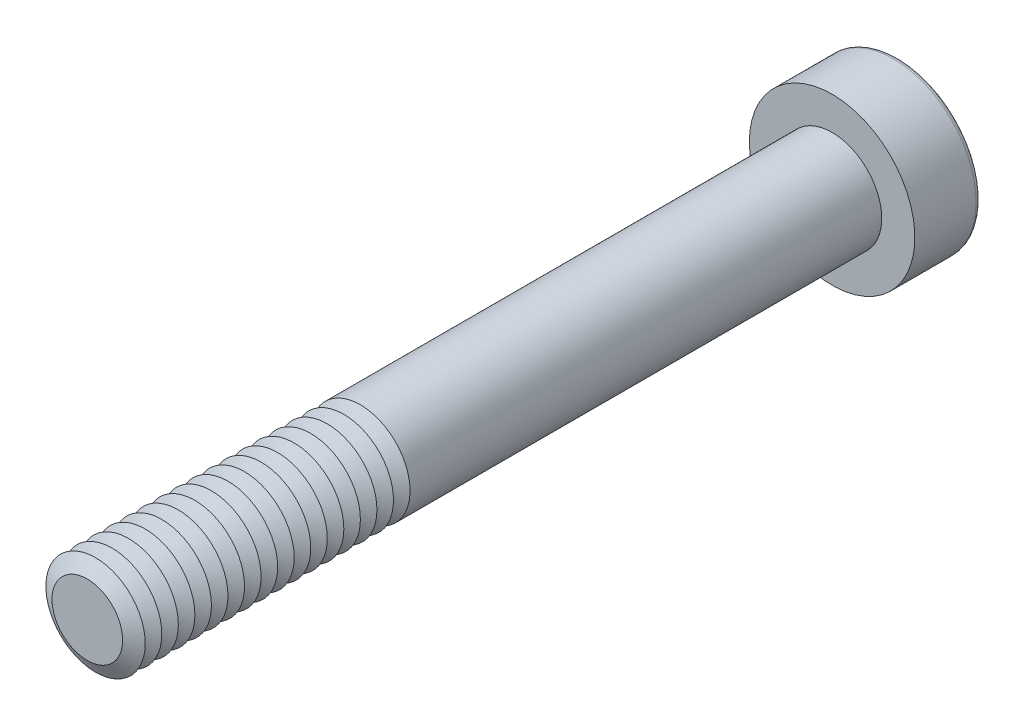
SolidWorks part; units mm, degrees
ref_plane "Front Plane" through (0, 0, 0) normal (0, 0, 1) x (1, 0, 0)
ref_plane "Top Plane" through (0, 0, 0) normal (0, 1, 0) x (1, 0, 0)
ref_plane "Right Plane" through (0, 0, 0) normal (1, 0, 0) x (0, 0, -1)
sketch "Sketch1" plane through (0, 0, 0) normal (0, 0, 1) x (1, 0, 0)
  circle A0 centre (0, 0) radius 3
  dimension "D1" = 6
extrude "Boss-Extrude1" add sketch "Sketch1" along normal blind 45
sketch "Sketch2" plane through (0, 0, 0) normal (0, 0, -1) x (-1, 0, 0)
  circle A0 centre (0, 0) radius 5
  dimension "D1" = 10
extrude "Boss-Extrude2" add sketch "Sketch2" along normal blind 4
sketch "Sketch3" plane through (0, 0, -4) normal (0, 0, -1) x (-1, 0, 0)
  line L1 (-1.1547, 2) -> (-2.3094, 0)
  line L2 (-2.3094, 0) -> (-1.1547, -2)
  line L3 (-1.1547, -2) -> (1.1547, -2)
  line L4 (1.1547, -2) -> (2.3094, 0)
  line L5 (2.3094, 0) -> (1.1547, 2)
  line L6 (1.1547, 2) -> (-1.1547, 2)
  circle A0 centre (0, 0) radius 2 construction
  dimension "D1" = 4
extrude "Cut-Extrude1" cut sketch "Sketch3" against normal blind 3
fillet "Fillet1" radius 0.3 1 edges at (-5, 0, -4)
sketch "Sketch4" plane through (0, 0, -1) normal (0, 0, -1) x (-1, 0, 0)
  line L0 (1.1547, -2) -> (2.3094, 0) construction
  circle A0 centre (0, 0) radius 2
extrude "Cut-Extrude2" cut sketch "Sketch4" against normal through all draft 60
sketch "Sketch5" plane through (0, 0, -4) normal (0, 0, -1) x (-1, 0, 0)
  circle A0 centre (0, 0) radius 2.3094
extrude "Cut-Extrude3" cut sketch "Sketch5" against normal through all draft 75
sketch "Sketch7" plane through (0, 0, 0) normal (1, 0, 0) x (0, 0, -1)
  line L25 (-45, 2.134) -> (-44.5, 3)
  line L26 (-45, 3) -> (-45, -3) construction
  line L27 (-44.5, 3) -> (-45.5, 3)
  line L28 (-45.5, 3) -> (-45, 2.134)
  line L29 (0, 3) -> (-45, 3) construction
  dimension "D1" = 1
revolve "Cut-Revolve1" cut sketch "Sketch7" angle 360 about axis through (0, 0, 45) along (0, 0, -1)
pattern_linear "LPattern1" count 17 spacing 1 along (0, 0, -1) of "Cut-Revolve1"
